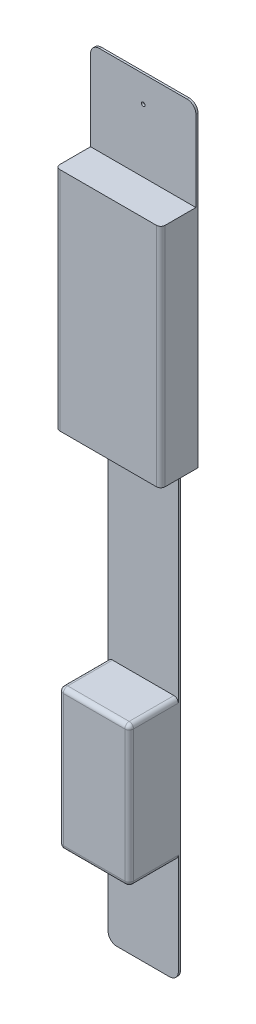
SolidWorks part; units mm, degrees
ref_plane "Front Plane" through (0, 0, 0) normal (0, 0, 1) x (1, 0, 0)
ref_plane "Top Plane" through (0, 0, 0) normal (0, 1, 0) x (1, 0, 0)
ref_plane "Right Plane" through (0, 0, 0) normal (1, 0, 0) x (0, 0, -1)
sketch "Sketch1" plane through (0, 0, 0) normal (0, 0, 1) x (1, 0, 0)
  line L0 (-38.1, 0) -> (38.1, 0)
  line L1 (38.1, 0) -> (38.1, -228.6)
  line L2 (38.1, -228.6) -> (25.4, -228.6)
  line L3 (25.4, -228.6) -> (25.4, -556.26)
  line L4 (25.4, -556.26) -> (-25.4, -556.26)
  line L5 (-25.4, -556.26) -> (-25.4, -228.6)
  line L6 (-25.4, -228.6) -> (-38.1, -228.6)
  line L7 (-38.1, -228.6) -> (-38.1, 0)
  point P7 (0, 0)
  dimension "D1" = 25.4
  dimension "D2" = 38.1
  dimension "D3" = 228.6
  dimension "D4" = 556.26
extrude "Boss-Extrude1" add sketch "Sketch1" along normal blind 1.524
fillet "Fillet1" radius 6.35 4 edges at (25.4, -556.26, 0.762) (-25.4, -556.26, 0.762) (-38.1, 0, 0.762) (38.1, 0, 0.762)
sketch "Sketch2" plane through (0, 0, 1.524) normal (0, 0, 1) x (1, 0, 0)
  line L0 (-38.1, -64.77) -> (38.1, -64.77)
  line L1 (-38.1, -6.35) -> (-38.1, -228.6) construction
  line L2 (38.1, -228.6) -> (38.1, -6.35) construction
  line L3 (38.1, -64.77) -> (38.1, -228.6)
  line L4 (38.1, -228.6) -> (-38.1, -228.6)
  line L5 (-38.1, -228.6) -> (-38.1, -64.77)
  dimension "D1" = 163.83
extrude "Boss-Extrude2" add sketch "Sketch2" along normal blind 25.4
sketch "Sketch3" plane through (0, 0, 1.524) normal (0, 0, 1) x (1, 0, 0)
  line L0 (-25.4, -228.6) -> (-25.4, -549.91) construction
  line L1 (-25.4, -378.46) -> (25.4, -378.46)
  line L2 (25.4, -549.91) -> (25.4, -228.6) construction
  line L3 (25.4, -378.46) -> (25.4, -480.06)
  line L4 (25.4, -480.06) -> (-25.4, -480.06)
  line L5 (-25.4, -480.06) -> (-25.4, -378.46)
  line L6 (-19.05, -556.26) -> (19.05, -556.26) construction
  dimension "D1" = 76.2
  dimension "D2" = 101.6
extrude "Boss-Extrude3" add sketch "Sketch3" along normal blind 35.56
fillet "Fillet2" radius 3.175 10 edges at (38.1, -146.685, 26.924) (-38.1, -146.685, 26.924) (-25.4, -480.06, 19.304) (-25.4, -378.46, 19.304) (25.4, -480.06, 19.304) (0, -480.06, 37.084) (-25.4, -429.26, 37.084) (0, -378.46, 37.084) (25.4, -429.26, 37.084) (25.4, -378.46, 19.304)
hole_wizard "Tap Drill for #6-32 Tap1" positions "Sketch4" profile "Sketch5" hole size "#6-32" standard "ANSI Inch"
sketch "Sketch4" plane through (0, 0, 0) normal (0, 0, -1) x (-1, 0, 0)
  line L0 (-25.4, -549.91) -> (-25.4, -228.6) construction
  line L1 (38.1, -228.6) -> (25.4, -228.6) construction
  point P0 (0, -19.05)
  point P2 (0, -501.65)
  point P11 (0, 0)
  dimension "D1" = 19.05
  dimension "D2" = 482.6
sketch "Sketch5" plane through (0, -19.05, 0) normal (1, 0, 0) x (0, 1, 0)
  line L0 (0, 0) -> (0, 37.084)
  line L1 (0, 37.084) -> (1.3525, 37.084)
  line L2 (1.3525, 37.084) -> (1.3525, 0)
  line L5 (1.3525, 0) -> (0, 0)
  line L11 (0, -6.35) -> (0, 107.95) construction
  dimension "Thru Hole Dia." = 2.7051
  dimension "Thru Hole Depth" = 37.084
